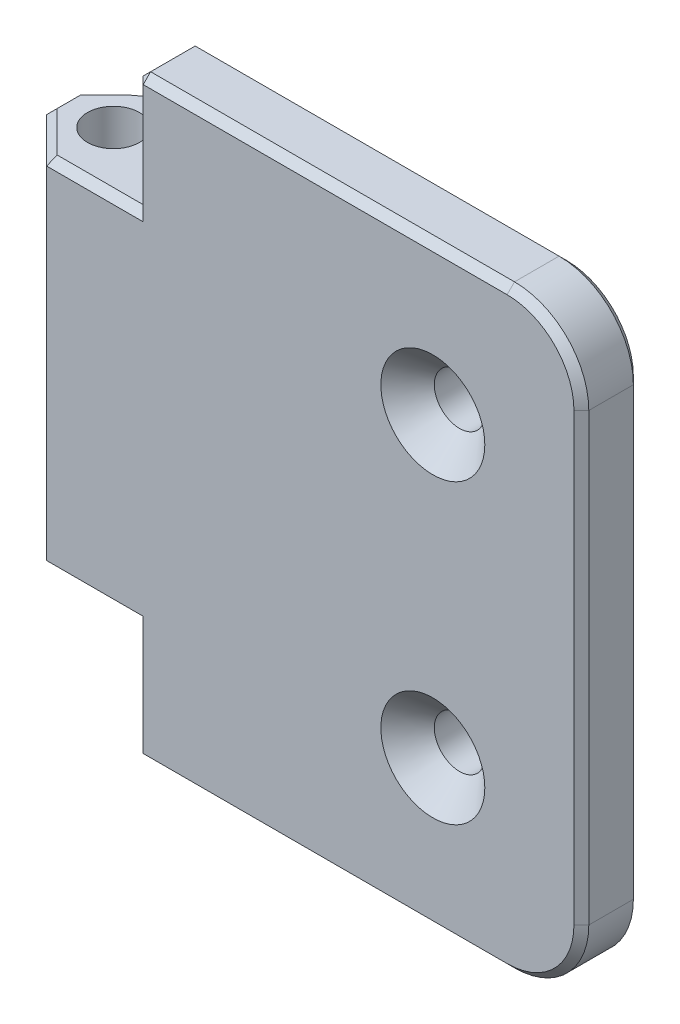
SolidWorks part; units mm, degrees
ref_plane "Ebene vorne" through (0, 0, 0) normal (0, 0, 1) x (1, 0, 0)
ref_plane "Ebene oben" through (0, 0, 0) normal (0, 1, 0) x (1, 0, 0)
ref_plane "Ebene rechts" through (0, 0, 0) normal (1, 0, 0) x (0, 0, -1)
sketch "Skizze1" plane through (0, 0, 0) normal (0, 0, 1) x (1, 0, 0)
  line L1 (0, 0) -> (-39, 0)
  line L2 (0, 0) -> (0, -40)
  line L3 (0, -40) -> (-39, -40)
  line L4 (-39, 0) -> (-39, -40)
  dimension "D1" = 40
  dimension "D2" = 39
extrude "Aufsatz-Linear austragen1" add sketch "Skizze1" against normal blind 8
sketch "Skizze2" plane through (0, 0, 0) normal (0, 1, 0) x (1, 0, 0)
  line L1 (0, 8) -> (-30, 8)
  line L2 (0, 8) -> (0, 4)
  line L3 (0, 4) -> (-30, 4)
  line L4 (-30, 8) -> (-30, 4)
  dimension "D1" = 4
  dimension "D2" = 30
extrude "Schnitt-Linear austragen1" cut sketch "Skizze2" against normal through all
hole_wizard "Formsenkung für M3 Senkschraube mit Innensechskant1" positions "Skizze3" profile "Skizze4" countersink size "M3" standard "DIN"
sketch "Skizze3" plane through (0, 0, 0) normal (0, 0, 1) x (1, 0, 0)
  line L0 (0, -40) -> (0, 0) construction
  line L1 (0, 0) -> (-39, 0) construction
  line L2 (-39, -40) -> (0, -40) construction
  point P0 (-10, -10)
  point P2 (-10, -30)
  dimension "D1" = 10
  dimension "D2" = 10
  dimension "D3" = 10
sketch "Skizze4" plane through (-10, -10, 0) normal (1, 0, 0) x (0, -1, 0)
  line L0 (0, 0) -> (0, 8)
  line L1 (0, 8) -> (1.7, 8)
  line L2 (1.7, 8) -> (1.7, 1.8)
  line L3 (1.7, 1.8) -> (3.5, 0)
  line L5 (3.5, 0) -> (0, 0)
  line L6 (-1.7, 1.8) -> (-3.5, 0) construction
  line L11 (0, -6.35) -> (0, 107.95) construction
  dimension "Bohrerdurchmesser" = 3.4
  dimension "Bohrungstiefe" = 8
  dimension "Senkdurchmesser (Oben)" = 7
  dimension "Senkwinkel (Oben)" = 90
hole_wizard "Ø3.5 (3.5) Durchmesser Bohrung1" positions "Skizze5" profile "Skizze6" hole size "Ø3.5" standard "DIN"
sketch "Skizze5" plane through (0, 0, 0) normal (0, 1, 0) x (1, 0, 0)
  line L0 (-39, 4) -> (-35.5, 4) construction
  line L1 (-39, 8) -> (-39, 0) construction
  point P0 (-35.5, 4)
  dimension "D1" = 3.5
sketch "Skizze6" plane through (-35.5, 0, -4) normal (1, 0, 0) x (0, 0, 1)
  line L0 (0, 0) -> (0, 40)
  line L1 (0, 40) -> (1.75, 40)
  line L2 (1.75, 40) -> (1.75, 0)
  line L5 (1.75, 0) -> (0, 0)
  line L11 (0, -6.35) -> (0, 107.95) construction
  dimension "Bohrerdurchmesser" = 3.5
  dimension "Bohrungstiefe" = 40
fillet "Verrundung1" radius 5 2 edges at (0, -40, -2) (0, 0, -2)
sketch "Skizze7" plane through (0, 0, 0) normal (0, 0, 1) x (1, 0, 0)
  line L0 (-5, 0) -> (-39, 0) construction
  line L1 (-39, 0) -> (-30, 0)
  line L2 (-39, 0) -> (-39, -8)
  line L3 (-39, -8) -> (-30, -8)
  line L4 (-30, 0) -> (-30, -8)
  line L5 (-39, 0) -> (-39, -40) construction
  line L6 (-30, -40) -> (-30, 0) construction
  line L7 (-39, -40) -> (-30, -40)
  line L8 (-39, -40) -> (-39, -32)
  line L9 (-39, -32) -> (-30, -32)
  line L10 (-30, -40) -> (-30, -32)
  dimension "D1" = 8
extrude "Schnitt-Linear austragen2" cut sketch "Skizze7" against normal through all
chamfer "Fase3" distance 3 angle 45 2 edges at (-39, -20, -8) (-39, -20, 0)
fillet "Verrundung2" radius 5 1 edges at (-36, -20, -8)
chamfer "Fase1" distance 0.5 angle 45 29 edges at (-17.5, -40, 0) (-1.4645, -38.5355, 0) (0, -20, 0) (-1.4645, -1.4645, 0) (-17.5, 0, 0) (-17.5, -40, -4) (-1.4645, -38.5355, -4) (0, -20, -4) (-1.4645, -1.4645, -4) (-17.5, 0, -4) (-30, -20, -8) (-39, -32, -4) (-39, -8, -4) (-30, -40, -2) (-30, -36, 0) (-33, -32, 0) (-31.9645, -32, -8) (-31.9645, -8, -8) (-30, 0, -2) (-33, -8, 0) (-30, -4, 0) (-30, -36, -4) (-30, -4, -4) (-37.5, -32, -1.5) (-38.2322, -32, -5.7678) (-38.2322, -8, -5.7678) (-35.8423, -32, -7.6194) (-35.8423, -8, -7.6194) (-37.5, -8, -1.5)
chamfer "Fase2" distance 0.5 angle 45 2 edges at (-30, -32, -5.75) (-30, -8, -5.75)
